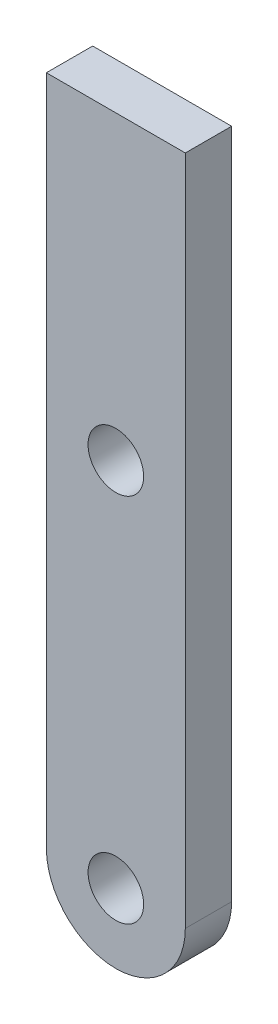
SolidWorks part; units mm, degrees
ref_plane "Face" through (0, 0, 0) normal (0, 0, 1) x (1, 0, 0)
ref_plane "Dessus" through (0, 0, 0) normal (0, 1, 0) x (1, 0, 0)
ref_plane "Droite" through (0, 0, 0) normal (1, 0, 0) x (0, 0, -1)
sketch "Esquisse1" plane through (0, 0, 0) normal (0, 0, 1) x (1, 0, 0)
  line L1 (0, 0) -> (30, 0)
  line L2 (0, 0) -> (0, -145)
  line L4 (30, 0) -> (30, -145)
  arc A0 (0, -145) -> (30, -145) centre (15, -145) ccw
  dimension "D1" = 30
extrude "Extrusion1" add sketch "Esquisse1" along normal blind 10
sketch "Esquisse2" plane through (0, 0, 10) normal (0, 0, 1) x (1, 0, 0)
  circle A0 centre (15, -145) radius 6
  circle A1 centre (15, -65) radius 6
  dimension "D1" = 80
extrude "Enlèv. mat.-Extru.1" cut sketch "Esquisse2" against normal blind 10
